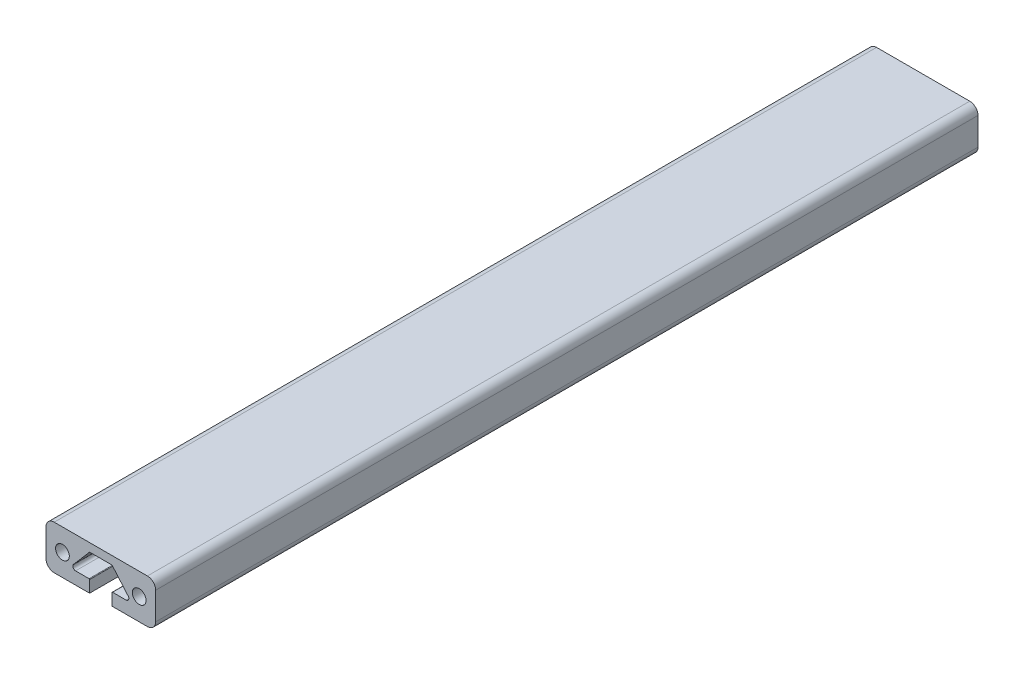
SolidWorks part; units mm, degrees
ref_plane "前视基准面" through (0, 0, 0) normal (0, 0, 1) x (1, 0, 0)
ref_plane "上视基准面" through (0, 0, 0) normal (0, 1, 0) x (1, 0, 0)
ref_plane "右视基准面" through (0, 0, 0) normal (1, 0, 0) x (0, 0, -1)
sketch "草图1"
sketch_block_instance "A$C50E9266C-1"
sketch_block "A$C50E9266C"
extrude "凸台-拉伸1" add sketch "草图1" along normal mid plane 300
